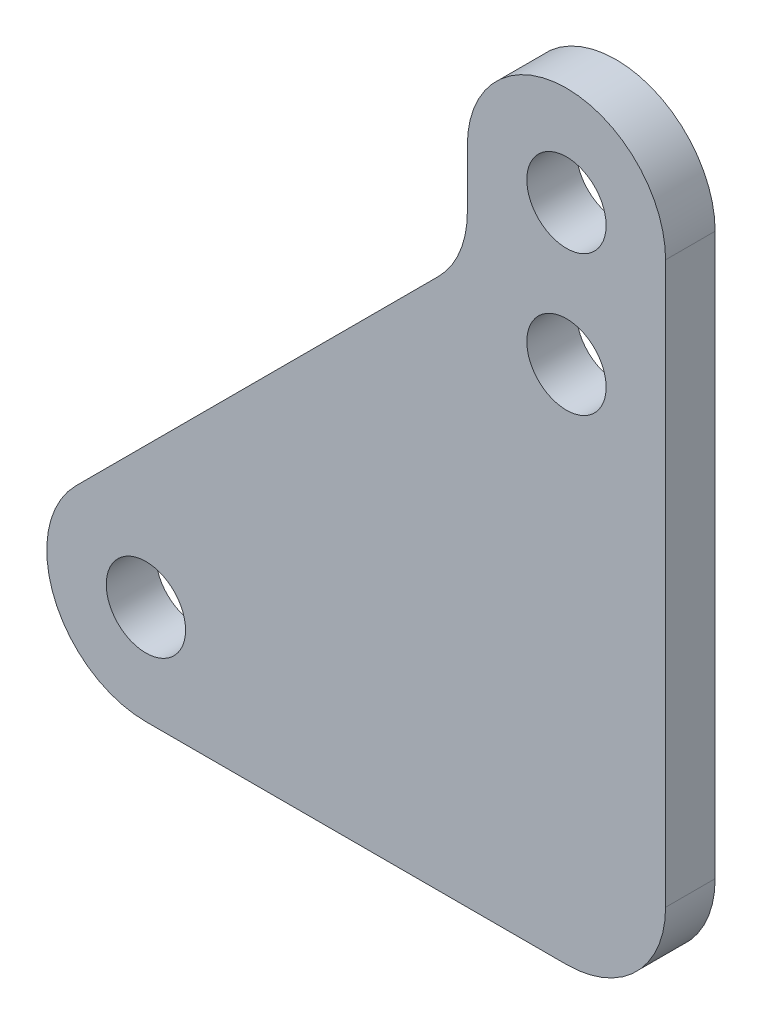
SolidWorks part; units mm, degrees
ref_plane "Front Plane" through (0, 0, 0) normal (0, 0, 1) x (1, 0, 0)
ref_plane "Top Plane" through (0, 0, 0) normal (0, 1, 0) x (1, 0, 0)
ref_plane "Right Plane" through (0, 0, 0) normal (1, 0, 0) x (0, 0, -1)
sketch "Sketch1" plane through (0, 0, 0) normal (0, 0, 1) x (1, 0, 0)
  line L0 (34.1421, 34.1421) -> (107.2792, 107.2792)
  line L1 (153.1371, 133.1328) -> (153.1371, 20)
  line L2 (133.1371, 0) -> (48.2843, 0)
  line L3 (113.1371, 133.1328) -> (113.1371, 121.4214)
  line L4 (113.1371, 133.1328) -> (133.1371, 133.1328) construction
  line L5 (133.1371, 133.1328) -> (153.1371, 133.1328) construction
  circle A0 centre (48.2843, 20) radius 8
  circle A1 centre (133.1371, 104.8528) radius 8
  arc A2 (133.1371, 0) -> (153.1371, 20) centre (133.1371, 20) ccw
  arc A3 (34.1421, 34.1421) -> (48.2843, 0) centre (48.2843, 20) ccw
  circle A4 centre (133.1371, 133.1328) radius 8
  arc A5 (153.1371, 133.1328) -> (113.1371, 133.1328) centre (133.1371, 133.1328) ccw
  arc A6 (113.1371, 121.4214) -> (107.2792, 107.2792) centre (93.1371, 121.4214) cw
  point P23 (0, 0)
  dimension "D2" = 16
  dimension "D3" = 16
  dimension "D9" = 20
  dimension "D10" = 16
  dimension "D12" = 20
  dimension "D13" = 20
  dimension "D1" = 135
  dimension "D4" = 120
  dimension "D5" = 20
  dimension "D6" = 20
  dimension "D7" = 20
  dimension "D8" = 20
  dimension "D11" = 28.28
extrude "Boss-Extrude1" add sketch "Sketch1" along normal blind 10
